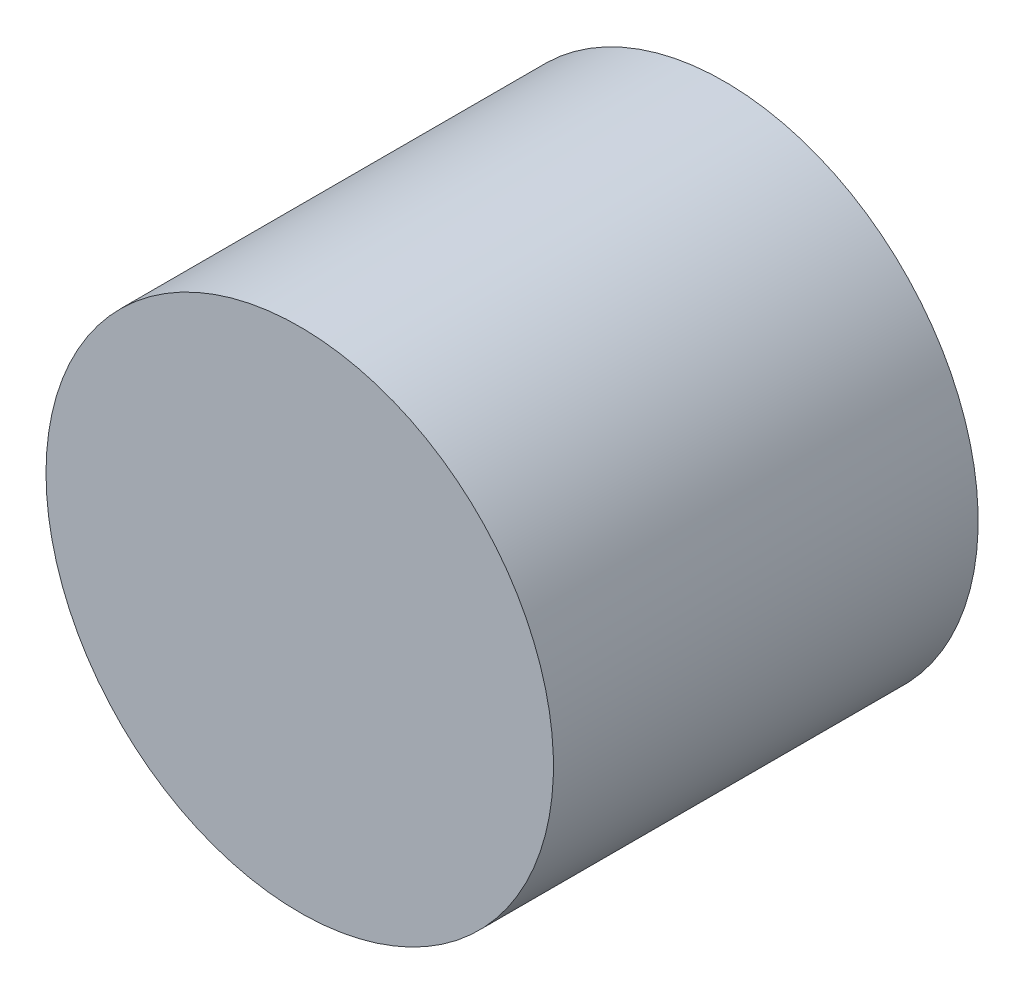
SolidWorks part; units mm, degrees
ref_plane "Plane1" through (0, 0, 0) normal (0, 0, 1) x (1, 0, 0)
ref_plane "Plane2" through (0, 0, 0) normal (0, 1, 0) x (1, 0, 0)
ref_plane "Plane3" through (0, 0, 0) normal (1, 0, 0) x (0, 0, -1)
sketch "Sketch1" plane through (0, 0, 0) normal (0, 0, 1) x (1, 0, 0)
  circle A2 centre (-0.7394, 0.6843) radius 4.6
extrude "rubber feet" add sketch "Sketch1" along normal blind 7.7
equation "\"result\"= 0.000512"
equation "\"result\"= 5*1"
equation "\"result\"= 5.000000*0.950000"
